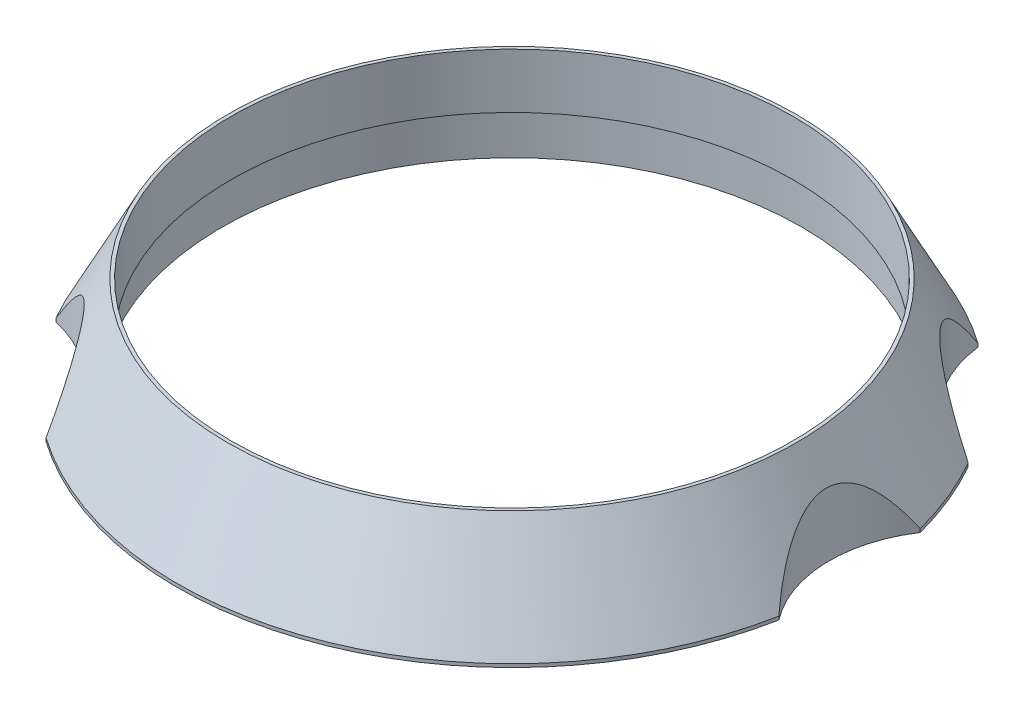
SolidWorks part; units mm, degrees
ref_plane "Front Plane" through (0, 0, 0) normal (0, 0, 1) x (1, 0, 0)
ref_plane "Top Plane" through (0, 0, 0) normal (0, 1, 0) x (1, 0, 0)
ref_plane "Right Plane" through (0, 0, 0) normal (1, 0, 0) x (0, 0, -1)
sketch "Sketch1" plane through (0, 0, 0) normal (0, 0, 1) x (1, 0, 0)
  line L0 (-106.6927, 38.1) -> (-107.9627, 38.1)
  line L1 (-107.9627, 38.1) -> (-127, 1.27)
  line L2 (-127, 1.27) -> (-127, 0)
  line L3 (-127, 0) -> (-110.0455, 0)
  line L4 (-110.0455, 0) -> (-110.0455, 17.272)
  line L5 (-110.0455, 17.272) -> (-106.6927, 17.272)
  line L6 (-106.6927, 17.272) -> (-106.6927, 38.1)
  line L7 (0, 0) -> (0, 74.7397) construction
  dimension "D1" = 1.27
  dimension "D2" = 220.091
  dimension "D3" = 1.27
  dimension "D4" = 213.3854
  dimension "D5" = 254
  dimension "D6" = 38.1
  dimension "D7" = 17.272
revolve "Revolve1" add sketch "Sketch1" angle 360 about L7
sketch "Sketch5" plane through (0, 38.1, 0) normal (0, 1, 0) x (1, 0, 0)
  circle A2 centre (-162.7805, -5.6214) radius 47.879
  circle A3 centre (-162.7805, -5.6214) radius 47.879
  circle A5 centre (-120.4698, -109.618) radius 47.879
  circle A6 centre (-120.4698, -109.618) radius 47.879
  circle A8 centre (120.4698, 109.618) radius 47.879
  circle A9 centre (120.4698, 109.618) radius 47.879
  circle A11 centre (162.7805, 5.6214) radius 47.879
  circle A12 centre (162.7805, 5.6214) radius 47.879
  dimension "D1" = 0.254
  dimension "D2" = 0.254
  dimension "D3" = 0.254
  dimension "D4" = 0.254
extrude "Cut-Extrude1" cut sketch "Sketch5" against normal through all
hole_wizard "1/4-20 Tapped Hole1" positions "Sketch4" profile "Sketch3" tap size "1/4-20" standard "ANSI Inch"
sketch "Sketch4" plane through (0, 0, 0) normal (0, -1, 0) x (-1, 0, 0)
  line L7 (23.7537, -124.7588) -> (19.9555, -104.8099) construction
  line L20 (-21.8546, 114.7843) -> (-95.7821, -66.9242) construction
  line L21 (-21.8546, 114.7843) -> (95.7821, 66.9242) construction
  line L22 (-95.7821, -66.9242) -> (21.8546, -114.7843) construction
  line L23 (95.7821, 66.9242) -> (21.8546, -114.7843) construction
  line L24 (-21.8546, 114.7843) -> (21.8546, -114.7843) construction
  line L25 (-95.7821, -66.9242) -> (95.7821, 66.9242) construction
  line L26 (72.9244, -103.9761) -> (-124.8008, -23.5323) construction
  line L29 (-36.9638, -90.8543) -> (0, 0) construction
  circle A1 centre (0, 0) radius 106.6927 construction
  arc A2 (-124.8008, -23.5323) -> (72.9244, -103.9761) centre (0, 0) ccw construction
  point P1 (-95.7821, -66.9242)
  point P214 (95.7821, 66.9242)
  point P215 (21.8546, -114.7843)
  point P216 (-21.8546, 114.7843)
  point P255 (0, 0)
  point P355 (0, 0)
  dimension "D1" = 127
sketch "Sketch3" plane through (95.7821, 0, 66.9242) normal (1, 0, 0) x (0, 0, -1)
  line L0 (0, 0) -> (0, 12.7)
  line L1 (0, 12.7) -> (2.5527, 12.7)
  line L2 (2.5527, 12.7) -> (2.5527, 8.89)
  line L3 (2.5527, 8.89) -> (3.175, 8.89)
  line L4 (3.175, 8.89) -> (3.175, 0)
  line L5 (3.175, 0) -> (0, 0)
  line L10 (0, 12.7) -> (-2.5527, 12.7) construction
  line L11 (0, -6.35) -> (0, 107.95) construction
  dimension "Tap Drill Dia." = 5.1054
  dimension "Tap Drill Depth" = 12.7
  dimension "Thread Major Dia." = 6.35
  dimension "Thread Depth" = 8.89
  dimension "Drill Angle" = 180
